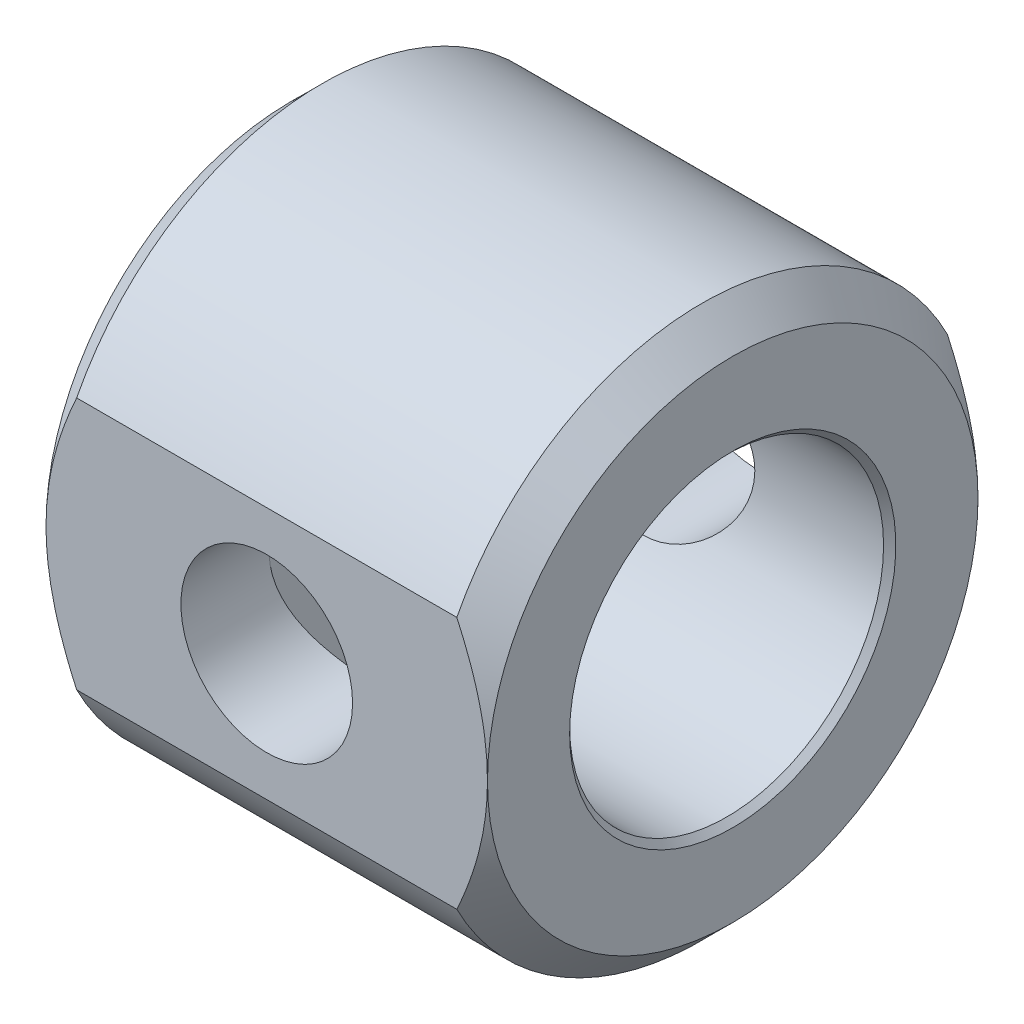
SolidWorks part; units mm, degrees
ref_plane "Plan1" through (0, 0, 0) normal (0, 0, 1) x (1, 0, 0)
ref_plane "Plan2" through (0, 0, 0) normal (0, 1, 0) x (1, 0, 0)
ref_plane "Plan3" through (0, 0, 0) normal (1, 0, 0) x (0, 0, -1)
sketch "Esquisse1" plane through (0, 0, 0) normal (0, 0, 1) x (1, 0, 0)
  line L0 (0, 0) -> (110, 0) construction
  line L1 (0, 9.25) -> (0, 22.5)
  line L2 (0, 22.5) -> (36, 22.5)
  line L3 (36, 22.5) -> (36, 12.8)
  line L5 (36, 12.8) -> (11, 12.8)
  line L6 (11, 12.8) -> (11, 9.25)
  line L7 (0, 9.25) -> (11, 9.25)
  dimension "D1" = 36
  dimension "D2" = 22.5
  dimension "D4" = 25
  dimension "D5" = 9.25
revolve "Base-Révolution" add sketch "Esquisse1"
chamfer "Chanfrein2" distance 0.5 angle 45 2 edges at (36, 0, 12.8) (0, 0, 9.25)
chamfer "Chanfrein1" distance 2.5 angle 45 2 edges at (36, 0, 22.5) (0, 0, 22.5)
sketch "Esquisse2" plane through (36, 0, 0) normal (1, 0, 0) x (0, 0, -1)
  line L0 (-26.6084, 0) -> (26.1297, 0) construction
  line L1 (0, 25.6111) -> (0, -26.4887) construction
  line L2 (25, 15) -> (25, -15)
  line L3 (-20, 15) -> (-25, 15)
  line L4 (-20, 15) -> (-20, -15)
  line L5 (-20, -15) -> (-25, -15)
  line L6 (-25, 15) -> (-25, -15)
  line L7 (20, -15) -> (25, -15)
  line L8 (20, 15) -> (20, -15)
  line L9 (20, 15) -> (25, 15)
  dimension "D1" = 5
  dimension "D2" = 15
  dimension "D3" = 15
  dimension "D4" = 20
extrude "Enlèv. mat.-Extru.1" cut sketch "Esquisse2" against normal blind 36
sketch "Esquisse3" plane through (0, 0, 20) normal (0, 0, 1) x (1, 0, 0)
  line L0 (0, 0) -> (37.0846, 0) construction
  line L1 (33.5, 0) -> (36, 0) construction
  line L2 (0, 9.25) -> (0, -9.25) construction
  circle A0 centre (18, 0) radius 7
  dimension "D1" = 14
  dimension "D2" = 18
extrude "Enlèv. mat.-Extru.2" cut sketch "Esquisse3" against normal through all
sketch "Esquisse4" plane through (0, 0, 0) normal (0, 1, 0) x (1, 0, 0)
  line L4 (18, -20) -> (18, 20) construction
  point P6 (18, 0)
ref_plane "Plan4" through (0, 0, 20) normal (0, 1, 0) x (-1, 0, 0)
sketch "Esquisse7" plane through (0, 0, 20) normal (0, 1, 0) x (-1, 0, 0)
  line L0 (0, -40) -> (0, 0) construction
  line L1 (0, -40) -> (0, 0) construction
  line L2 (0, -20) -> (-9.3454, -20) construction
  line L4 (-0.125, -20.125) -> (2, -20.125)
  line L5 (-0.125, -20.125) -> (-0.125, -19.875)
  line L6 (-0.125, -19.875) -> (2, -19.875)
  line L7 (2, -20.125) -> (2, -19.875)
  dimension "D1" = 2
  dimension "D2" = 0.25
  dimension "D3" = 0.25
extrude "Enlèv. mat.-Extru.6" cut sketch "Esquisse7" along normal mid plane 124
